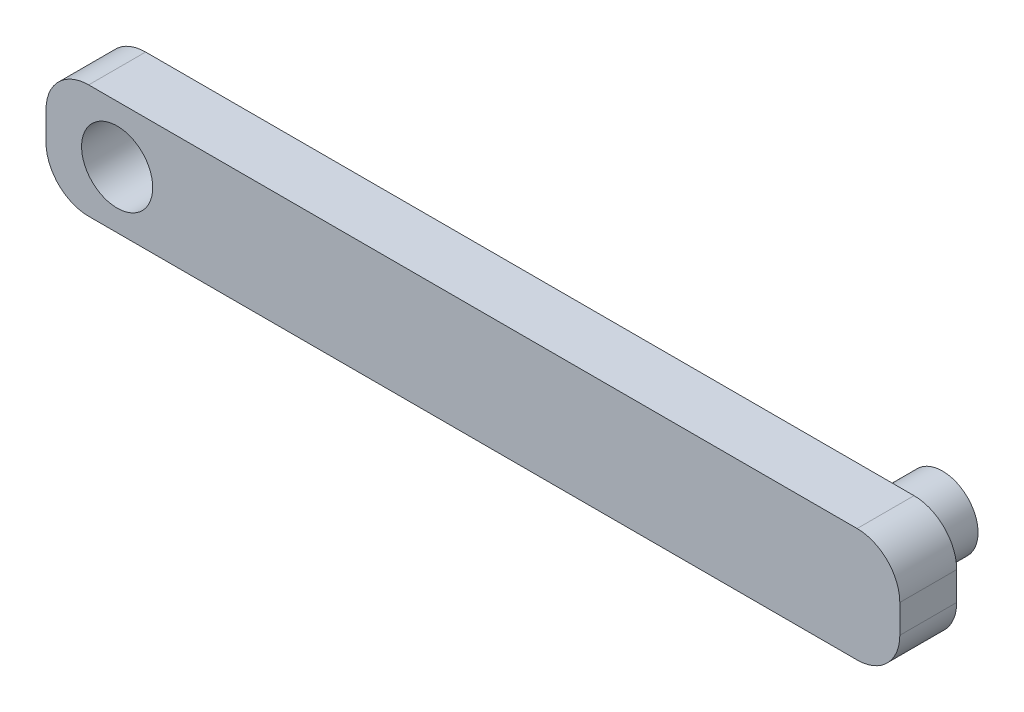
SolidWorks part; units mm, degrees
ref_plane "Face" through (0, 0, 0) normal (0, 0, 1) x (1, 0, 0)
ref_plane "Dessus" through (0, 0, 0) normal (0, 1, 0) x (1, 0, 0)
ref_plane "Droite" through (0, 0, 0) normal (1, 0, 0) x (0, 0, -1)
sketch "Esquisse1" plane through (0, 0, 0) normal (0, 0, 1) x (1, 0, 0)
  line L1 (726.8661, 57.0947) -> (996.8661, 57.0947)
  line L2 (711.8661, 42.0947) -> (711.8661, 32.0947)
  line L3 (726.8661, 17.0947) -> (996.8661, 17.0947)
  line L4 (1011.8661, 42.0947) -> (1011.8661, 32.0947)
  arc A0 (996.8661, 57.0947) -> (1011.8661, 42.0947) centre (996.8661, 42.0947) cw
  arc A1 (996.8661, 17.0947) -> (1011.8661, 32.0947) centre (996.8661, 32.0947) ccw
  arc A2 (711.8661, 32.0947) -> (726.8661, 17.0947) centre (726.8661, 32.0947) ccw
  arc A3 (726.8661, 57.0947) -> (711.8661, 42.0947) centre (726.8661, 42.0947) ccw
  point P6 (1011.8661, 57.0947)
  point P13 (711.8661, 57.0947)
  dimension "D2" = 15
  dimension "D1" = 300
  dimension "D3" = 40
extrude "Extrusion1" add sketch "Esquisse1" along normal blind 20
sketch "Esquisse2" plane through (0, 0, 20) normal (0, 0, 1) x (1, 0, 0)
  line L0 (996.8661, 57.0947) -> (726.8661, 57.0947) construction
  line L1 (711.8661, 42.0947) -> (711.8661, 32.0947) construction
  circle A0 centre (736.8661, 37.0947) radius 12.5
  dimension "D1" = 25
  dimension "D2" = 20
  dimension "D3" = 25
extrude "Enlèv. mat.-Extru.1" cut sketch "Esquisse2" against normal through all
sketch "Esquisse3" plane through (0, 0, 0) normal (0, 0, -1) x (-1, 0, 0)
  line L0 (-996.8661, 57.0947) -> (-726.8661, 57.0947) construction
  line L1 (-1011.8661, 32.0947) -> (-1011.8661, 42.0947) construction
  circle A0 centre (-986.8661, 37.0947) radius 12.5
  dimension "D1" = 25
  dimension "D2" = 20
  dimension "D3" = 25
extrude "Extrusion2" add sketch "Esquisse3" along normal blind 20
